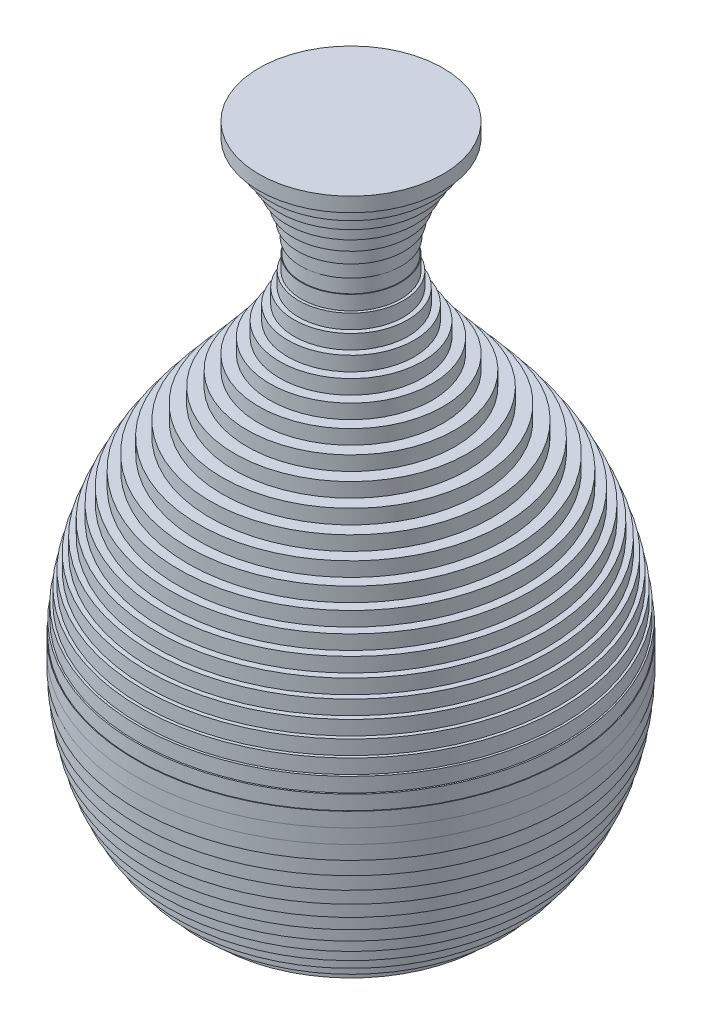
SolidWorks part; units mm, degrees
ref_plane "Front Plane" through (0, 0, 0) normal (0, 0, 1) x (1, 0, 0)
ref_plane "Top Plane" through (0, 0, 0) normal (0, 1, 0) x (1, 0, 0)
ref_plane "Right Plane" through (0, 0, 0) normal (1, 0, 0) x (0, 0, -1)
sketch "Sketch1" plane through (0, 0, 0) normal (0, 0, 1) x (1, 0, 0)
  line L0 (-100, 0) -> (100, 0) construction
  line L1 (-100, 5) -> (100, 5) construction
  line L2 (-100, 10) -> (100, 10) construction
  line L3 (-100, 15) -> (100, 15) construction
  line L4 (-100, 20) -> (100, 20) construction
  line L5 (-100, 25) -> (100, 25) construction
  line L6 (-100, 30) -> (100, 30) construction
  line L7 (-100, 35) -> (100, 35) construction
  line L8 (-100, 40) -> (100, 40) construction
  line L9 (-100, 45) -> (100, 45) construction
  line L10 (-100, 50) -> (100, 50) construction
  line L11 (-100, 55) -> (100, 55) construction
  line L12 (-100, 60) -> (100, 60) construction
  line L13 (-100, 65) -> (100, 65) construction
  line L14 (-100, 70) -> (100, 70) construction
  line L15 (-100, 75) -> (100, 75) construction
  line L16 (-100, 80) -> (100, 80) construction
  line L17 (-100, 85) -> (100, 85) construction
  line L18 (-100, 90) -> (100, 90) construction
  line L19 (-100, 95) -> (100, 95) construction
  line L20 (-100, 100) -> (100, 100) construction
  line L21 (-100, 105) -> (100, 105) construction
  line L22 (-100, 110) -> (100, 110) construction
  line L23 (-100, 115) -> (100, 115) construction
  line L24 (-100, 120) -> (100, 120) construction
  line L25 (-100, 125) -> (100, 125) construction
  line L26 (-100, 130) -> (100, 130) construction
  line L27 (-100, 135) -> (100, 135) construction
  line L28 (-100, 140) -> (100, 140) construction
  line L29 (-100, 145) -> (100, 145) construction
  line L30 (-100, 150) -> (100, 150) construction
  line L31 (-100, 155) -> (100, 155) construction
  line L32 (-100, 160) -> (100, 160) construction
  line L33 (-100, 165) -> (100, 165) construction
  line L34 (-100, 170) -> (100, 170) construction
  line L35 (-100, 175) -> (100, 175) construction
  line L36 (-100, 180) -> (100, 180) construction
  line L37 (-100, 185) -> (100, 185) construction
  line L38 (-100, 190) -> (100, 190) construction
  line L39 (-100, 195) -> (100, 195) construction
  line L40 (-100, 200) -> (100, 200) construction
  line L41 (-100, 205) -> (100, 205) construction
  line L42 (-100, 210) -> (100, 210) construction
  line L43 (-100, 215) -> (100, 215) construction
  line L44 (-100, 220) -> (100, 220) construction
  line L45 (-100, 225) -> (100, 225) construction
  line L46 (0, 0) -> (0, 225) construction
  line L47 (0, 225) -> (32, 225) construction
  line L48 (0, 0) -> (40, 0) construction
  line L49 (0, 225) -> (32, 225)
  line L50 (32, 225) -> (32, 220)
  line L51 (32, 220) -> (28.309, 220)
  line L52 (28.309, 220) -> (28.309, 215)
  line L53 (28.309, 215) -> (25.0757, 215)
  line L54 (25.0757, 215) -> (25.0757, 210)
  line L55 (25.0757, 210) -> (22.335, 210)
  line L56 (22.335, 210) -> (22.335, 205)
  line L57 (22.335, 205) -> (20.123, 205)
  line L58 (20.123, 205) -> (20.123, 200)
  line L59 (20.123, 200) -> (18.4762, 200)
  line L60 (18.4762, 200) -> (18.4762, 195)
  line L61 (18.4762, 195) -> (17.4298, 195)
  line L62 (17.4298, 195) -> (17.4298, 190)
  line L63 (17.4298, 190) -> (17.0157, 190)
  line L64 (17.0157, 190) -> (17.0157, 185)
  line L65 (17.0157, 185) -> (17.259, 185)
  line L66 (17.259, 185) -> (17.259, 180)
  line L67 (17.259, 180) -> (18.1745, 180)
  line L68 (18.1745, 180) -> (18.1745, 175)
  line L69 (18.1745, 175) -> (19.7618, 175)
  line L70 (19.7618, 175) -> (19.7618, 170)
  line L71 (19.7618, 170) -> (22, 170)
  line L72 (22, 170) -> (22, 165)
  line L73 (22, 165) -> (24.8436, 165)
  line L74 (24.8436, 165) -> (24.8436, 160)
  line L75 (24.8436, 160) -> (28.2195, 160)
  line L76 (28.2195, 160) -> (28.2195, 155)
  line L77 (28.2195, 155) -> (32.0275, 155)
  line L78 (32.0275, 155) -> (32.0275, 150)
  line L79 (32.0275, 150) -> (36.1451, 150)
  line L80 (36.1451, 150) -> (36.1451, 145)
  line L81 (36.1451, 145) -> (40.4353, 145)
  line L82 (40.4353, 145) -> (40.4353, 140)
  line L83 (40.4353, 140) -> (44.7579, 140)
  line L84 (44.7579, 140) -> (44.7579, 135)
  line L85 (44.7579, 135) -> (48.9805, 135)
  line L86 (48.9805, 135) -> (48.9805, 130)
  line L87 (48.9805, 130) -> (52.9871, 130)
  line L88 (52.9871, 130) -> (52.9871, 125)
  line L89 (52.9871, 125) -> (56.6837, 125)
  line L90 (56.6837, 125) -> (56.6837, 120)
  line L91 (56.6837, 120) -> (60, 120)
  line L92 (60, 120) -> (60, 115)
  line L93 (60, 115) -> (62.9026, 115)
  line L94 (62.9026, 115) -> (62.9026, 110)
  line L95 (62.9026, 110) -> (65.4246, 110)
  line L96 (65.4246, 110) -> (65.4246, 105)
  line L97 (65.4246, 105) -> (67.6032, 105)
  line L98 (67.6032, 105) -> (67.6032, 100)
  line L99 (67.6032, 100) -> (69.4662, 100)
  line L100 (69.4662, 100) -> (69.4662, 95)
  line L101 (69.4662, 95) -> (71.0344, 95)
  line L102 (71.0344, 95) -> (71.0344, 90)
  line L103 (71.0344, 90) -> (72.3229, 90)
  line L104 (72.3229, 90) -> (72.3229, 85)
  line L105 (72.3229, 85) -> (73.3425, 85)
  line L106 (73.3425, 85) -> (73.3425, 80)
  line L107 (73.3425, 80) -> (74.1003, 80)
  line L108 (74.1003, 80) -> (74.1003, 75)
  line L109 (74.1003, 75) -> (74.6, 75)
  line L110 (74.6, 75) -> (74.6, 70)
  line L111 (74.6, 70) -> (74.8423, 70)
  line L112 (74.8423, 70) -> (74.8423, 65)
  line L113 (74.8423, 65) -> (74.825, 65)
  line L114 (74.825, 65) -> (74.825, 60)
  line L115 (74.825, 60) -> (74.5427, 60)
  line L116 (74.5427, 60) -> (74.5427, 55)
  line L117 (74.5427, 55) -> (73.9867, 55)
  line L118 (73.9867, 55) -> (73.9867, 50)
  line L119 (73.9867, 50) -> (73.1448, 50)
  line L120 (73.1448, 50) -> (73.1448, 45)
  line L121 (73.1448, 45) -> (72, 45)
  line L122 (72, 45) -> (72, 40)
  line L123 (72, 40) -> (70.5303, 40)
  line L124 (70.5303, 40) -> (70.5303, 35)
  line L125 (70.5303, 35) -> (68.7065, 35)
  line L126 (68.7065, 35) -> (68.7065, 30)
  line L127 (68.7065, 30) -> (66.4904, 30)
  line L128 (66.4904, 30) -> (66.4904, 25)
  line L129 (66.4904, 25) -> (63.8313, 25)
  line L130 (63.8313, 25) -> (63.8313, 20)
  line L131 (63.8313, 20) -> (60.6599, 20)
  line L132 (60.6599, 20) -> (60.6599, 15)
  line L133 (60.6599, 15) -> (56.8797, 15)
  line L134 (56.8797, 15) -> (56.8797, 10)
  line L135 (56.8797, 10) -> (52.3493, 10)
  line L136 (52.3493, 10) -> (52.3493, 5)
  line L137 (52.3493, 5) -> (46.8484, 5)
  line L138 (46.8484, 5) -> (46.8484, 0)
  line L139 (46.8484, 0) -> (0, 0)
  line L140 (0, 0) -> (0, 225)
  spline S0 degree 3 poles (40, 0) (80.0689, 25.9508) (87.5409, 131.5964) (-6.2807, 176.0309) (32, 225) knots 0 0 0 0 0.52495 1 1 1 1 construction
  point P3 (0, 0)
  point P4 (0, 0)
  dimension "D1" = 200
  dimension "D3" = 5
  dimension "D4" = 32
  dimension "D5" = 40
  dimension "D6" = 22
  dimension "D7" = 60
  dimension "D8" = 72
  dimension "D2" = 46
revolve "Revolve1" add sketch "Sketch1" angle 360 about L140
